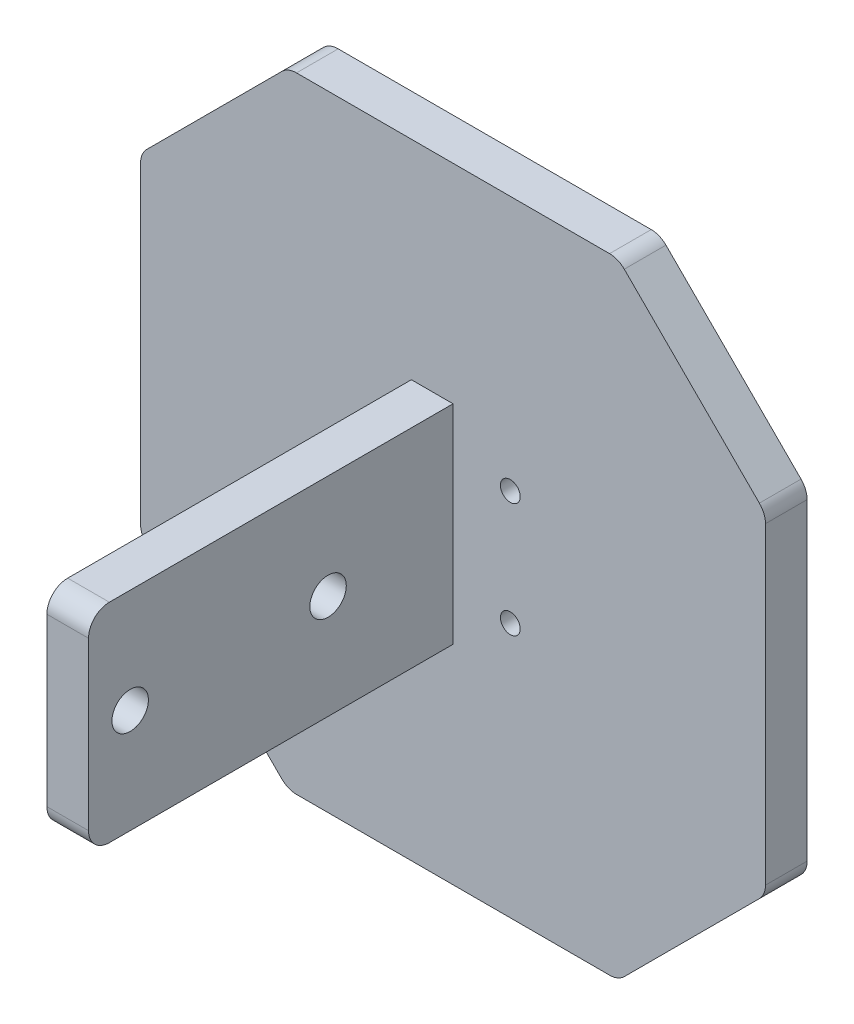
SolidWorks part; units mm, degrees
ref_plane "Plan de face" through (0, 0, 0) normal (0, 0, 1) x (1, 0, 0)
ref_plane "Plan de dessus" through (0, 0, 0) normal (0, 1, 0) x (1, 0, 0)
ref_plane "Plan de droite" through (0, 0, 0) normal (1, 0, 0) x (0, 0, -1)
sketch "Esquisse1" plane through (0, 0, 0) normal (0, 0, 1) x (1, 0, 0)
  line L0 (-30, 30) -> (30, -30) construction
  line L1 (-15.8579, 30) -> (15.8579, 30)
  line L2 (-30, 15.8579) -> (-30, -15.8579)
  line L3 (-15.8579, -30) -> (15.8579, -30)
  line L4 (30, 15.8579) -> (30, -15.8579)
  line L5 (-5.5, 5.5) -> (5.5, 5.5) construction
  line L6 (5.5, 5.5) -> (5.5, -5.5) construction
  line L7 (5.5, -5.5) -> (-5.5, -5.5) construction
  line L8 (-5.5, -5.5) -> (-5.5, 5.5) construction
  line L9 (-5.5, 5.5) -> (5.5, -5.5) construction
  line L10 (15.8579, 30) -> (30, 15.8579)
  line L11 (-30, -15.8579) -> (-15.8579, -30)
  line L12 (0, 30) -> (0, -30) construction
  line L13 (30, -15.8579) -> (15.8579, -30)
  line L14 (-15.8579, 30) -> (-30, 15.8579)
  arc A0 (-5.5, 4.55) -> (-5.5, 6.45) centre (-5.5, 5.5) ccw construction
  arc A1 (-5.5, 6.45) -> (-5.5, 4.55) centre (-5.5, 5.5) ccw construction
  circle A2 centre (5.5, 5.5) radius 0.95 construction
  arc A3 (-5.5, -6.45) -> (-5.5, -4.55) centre (-5.5, -5.5) ccw construction
  arc A4 (-5.5, -4.55) -> (-5.5, -6.45) centre (-5.5, -5.5) ccw construction
  circle A5 centre (5.5, -5.5) radius 0.95 construction
  arc A6 (-5.5, 4.55) -> (-5.5, 6.45) centre (-5.5, 5.5) ccw
  arc A7 (-5.5, 6.45) -> (-5.5, 4.55) centre (-5.5, 5.5) ccw
  circle A8 centre (5.5, 5.5) radius 0.95
  arc A9 (-5.5, -6.45) -> (-5.5, -4.55) centre (-5.5, -5.5) ccw
  arc A10 (-5.5, -4.55) -> (-5.5, -6.45) centre (-5.5, -5.5) ccw
  circle A11 centre (5.5, -5.5) radius 0.95
  dimension "D1" = 60
  dimension "D2" = 20
extrude "Boss.-Extru.1" add sketch "Esquisse1" along normal blind 4
sketch "Esquisse2" plane through (0, 0, 4) normal (0, 0, 1) x (1, 0, 0)
  line L0 (0, -30) -> (0, 30) construction
  line L1 (-4, -10) -> (0, -10)
  line L2 (-4, -10) -> (-4, 10)
  line L3 (-4, 10) -> (0, 10)
  line L4 (0, -10) -> (0, 10)
  line L5 (-15.8579, -30) -> (15.8579, -30) construction
  line L6 (15.8579, 30) -> (-15.8579, 30) construction
  dimension "D1" = 20
  dimension "D2" = 4
extrude "Boss.-Extru.2" add sketch "Esquisse2" along normal blind 35
sketch "Esquisse3" plane through (0, 0, 0) normal (1, 0, 0) x (0, 0, -1)
  line L0 (-39, 0) -> (0, 0) construction
  line L1 (-39, -10) -> (-39, 10) construction
  line L2 (-4, -15.8579) -> (-4, 15.8579) construction
  circle A0 centre (-16, 0) radius 1.75
  circle A1 centre (-35, 0) radius 1.75
  dimension "D1" = 3.5
  dimension "D2" = 3.5
  dimension "D3" = 19
  dimension "D4" = 12
extrude "Enlèv. mat.-Extru.1" cut sketch "Esquisse3" against normal through all
fillet "Congé1" radius 2 2 edges at (-2, 10, 39) (-2, -10, 39)
fillet "Congé2" radius 2 8 edges at (-30, 15.8579, 2) (-30, -15.8579, 2) (-15.8579, -30, 2) (15.8579, -30, 2) (30, -15.8579, 2) (30, 15.8579, 2) (15.8579, 30, 2) (-15.8579, 30, 2)
